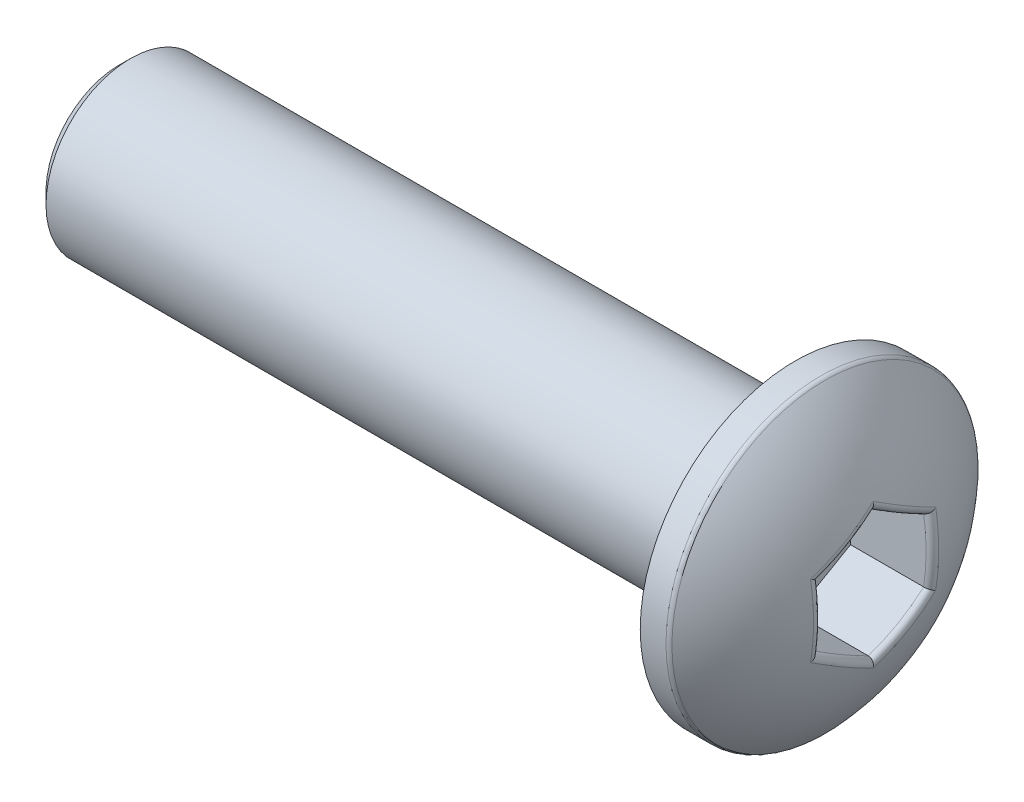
SolidWorks part; units mm, degrees
ref_plane "Plan1" through (0, 0, 0) normal (0, 0, 1) x (1, 0, 0)
ref_plane "Plan2" through (0, 0, 0) normal (0, 1, 0) x (1, 0, 0)
ref_plane "Plan3" through (0, 0, 0) normal (1, 0, 0) x (0, 0, -1)
sketch "Esquisse1" plane through (0, 0, 0) normal (0, 0, 1) x (1, 0, 0)
  line L0 (0, 0) -> (78.1518, 0) construction
  line L1 (0, 0) -> (0, 1.5)
  line L2 (0, 1.5) -> (12, 1.5)
  line L3 (12, 1.5) -> (12, 2.75)
  line L4 (12, 2.75) -> (12.5, 2.75)
  line L5 (0, 0) -> (13.5953, 0)
  arc A0 (13.5953, 0) -> (12.5, 2.75) centre (9.5953, 0) ccw
  dimension "D4" = 0.5
  dimension "D5" = 4
  dimension "D1" = 12
  dimension "D2" = 1.5
  dimension "D3" = 2.75
revolve "Révolution1" add sketch "Esquisse1" angle 360 about L0
ref_plane "Plan4" through (20, 0, 0) normal (-1, 0, 0) x (0, 0, 1)
sketch "Esquisse2" plane through (20, 0, 0) normal (-1, 0, 0) x (0, 0, 1)
  line L1 (0, 1.1352) -> (-0.9831, 0.5676)
  line L2 (-0.9831, 0.5676) -> (-0.9831, -0.5676)
  line L3 (-0.9831, -0.5676) -> (0, -1.1352)
  line L4 (0, -1.1352) -> (0.9831, -0.5676)
  line L5 (0.9831, -0.5676) -> (0.9831, 0.5676)
  line L6 (0.9831, 0.5676) -> (0, 1.1352)
  circle A0 centre (0, 0) radius 0.9831 construction
extrude "Enlèv. mat.-Extru.1" cut sketch "Esquisse2" along normal blind 8
sketch "Esquisse4" plane through (0, 0, 0) normal (-1, 0, 0) x (0, 0, 1)
  circle A1 centre (0, 0) radius 1.5
  circle A2 centre (0, 0) radius 1.5
  dimension "D1" = 0
chamfer "Chanfrein1" distance 0.2 angle 45
fillet "Congé1" radius 0.1
